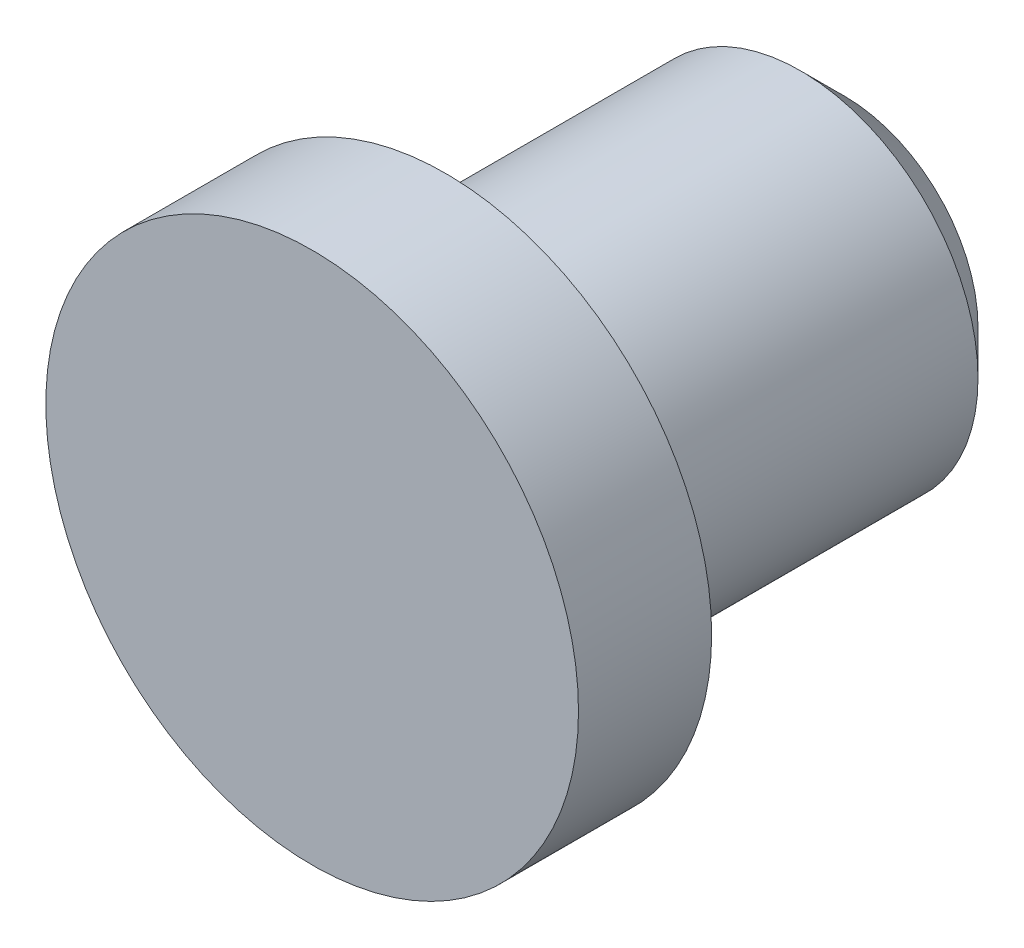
SolidWorks part; units mm, degrees
ref_plane "Plan de face" through (0, 0, 0) normal (0, 0, 1) x (1, 0, 0)
ref_plane "Plan de dessus" through (0, 0, 0) normal (0, 1, 0) x (1, 0, 0)
ref_plane "Plan de droite" through (0, 0, 0) normal (1, 0, 0) x (0, 0, -1)
sketch "Esquisse1" plane through (0, 0, 0) normal (0, 0, 1) x (1, 0, 0)
  circle A0 centre (0, 0) radius 4
  dimension "D1" = 8
extrude "Boss.-Extru.1" add sketch "Esquisse1" along normal blind 9
sketch "Esquisse2" plane through (0, 0, 9) normal (0, 0, 1) x (1, 0, 0)
  circle A0 centre (0, 0) radius 6
  dimension "D1" = 12
extrude "Boss.-Extru.2" add sketch "Esquisse2" along normal blind 3
chamfer "Chanfrein1" distance 1 angle 45 1 edges at (4, 0, 0)
